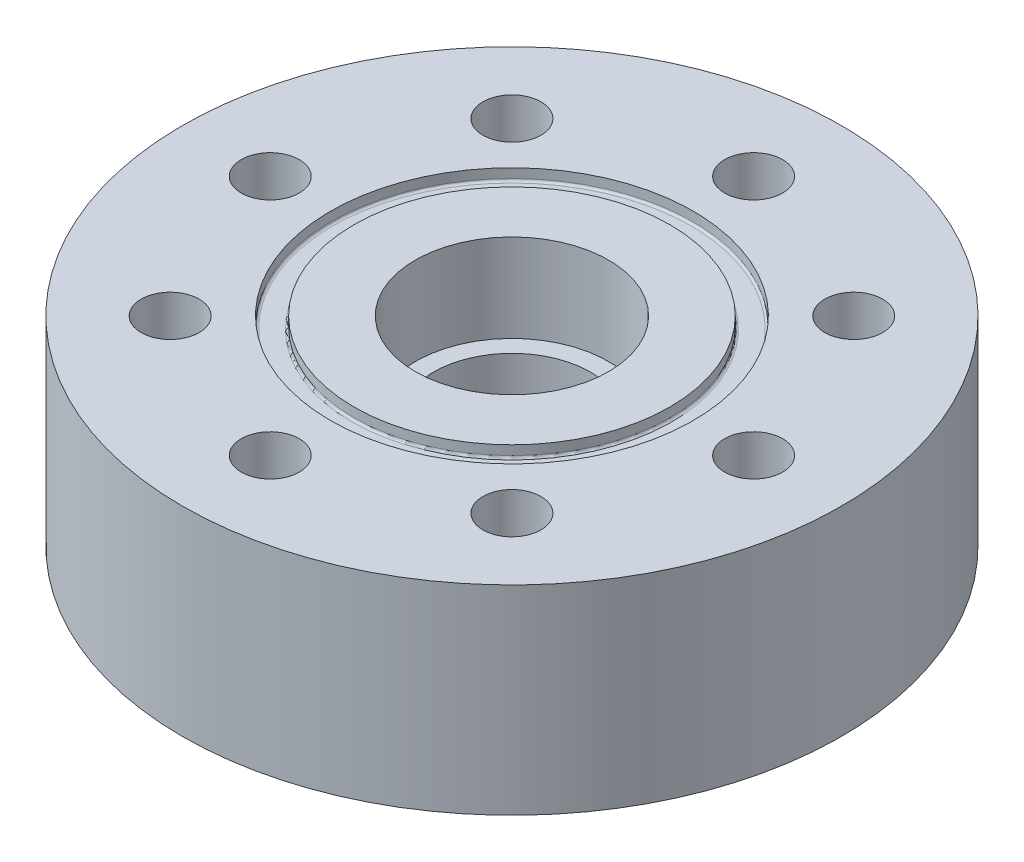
SolidWorks part; units mm, degrees
ref_plane "Front Plane" through (0, 0, 0) normal (0, 0, 1) x (1, 0, 0)
ref_plane "Top Plane" through (0, 0, 0) normal (0, 1, 0) x (1, 0, 0)
ref_plane "Right Plane" through (0, 0, 0) normal (1, 0, 0) x (0, 0, -1)
sketch "Sketch2" plane through (0, 0, 0) normal (0, 1, 0) x (1, 0, 0)
  circle A0 centre (0, 0) radius 37.5
  dimension "D1" = 75
extrude "Outer Cylinder" add sketch "Sketch2" along normal blind 22.7
sketch "Sketch3" plane through (0, 0, 0) normal (0, -1, 0) x (1, 0, 0)
  circle A0 centre (0, 0) radius 8.93
  dimension "D1" = 17.86
extrude "NPT Hole" cut sketch "Sketch3" against normal blind 12.7
sketch "Sketch4" plane through (0, 0, 0) normal (0, -1, 0) x (1, 0, 0)
  circle A0 centre (-27.5, 0) radius 3.3
  circle A1 centre (-19.4454, 19.4454) radius 3.3
  circle A2 centre (0, 27.5) radius 3.3
  circle A3 centre (19.4454, 19.4454) radius 3.3
  circle A4 centre (27.5, 0) radius 3.3
  circle A5 centre (19.4454, -19.4454) radius 3.3
  circle A6 centre (0, -27.5) radius 3.3
  circle A7 centre (-19.4454, -19.4454) radius 3.3
  point P19 (0, 0)
  dimension "D1" = 6.6
  dimension "D2" = 27.5
  dimension "D3" = 8
extrude "Bolt Holes" cut sketch "Sketch4" against normal through all
sketch "Sketch5" plane through (0, 22.7, 0) normal (0, 1, 0) x (1, 0, 0)
  circle A0 centre (0, 0) radius 17.9705
  circle A1 centre (0, 0) radius 20.6375
  dimension "D1" = 41.275
  dimension "D2" = 2.667
extrude "O-Ring Groove" cut sketch "Sketch5" against normal blind 1.3208
fillet "Fillet1" radius 0.254 2 edges at (0, 21.3792, 17.9705) (0, 21.3792, 20.6375)
sketch "Sketch6" plane through (0, 22.7, 0) normal (0, 1, 0) x (1, 0, 0)
  circle A0 centre (0, 0) radius 11
  dimension "D1" = 22
extrude "Inlet Flow Diameter" cut sketch "Sketch6" against normal blind 10
equation "\"D\"= 22"
equation "\"Inlet Flow Diameter\"= \"D\""
